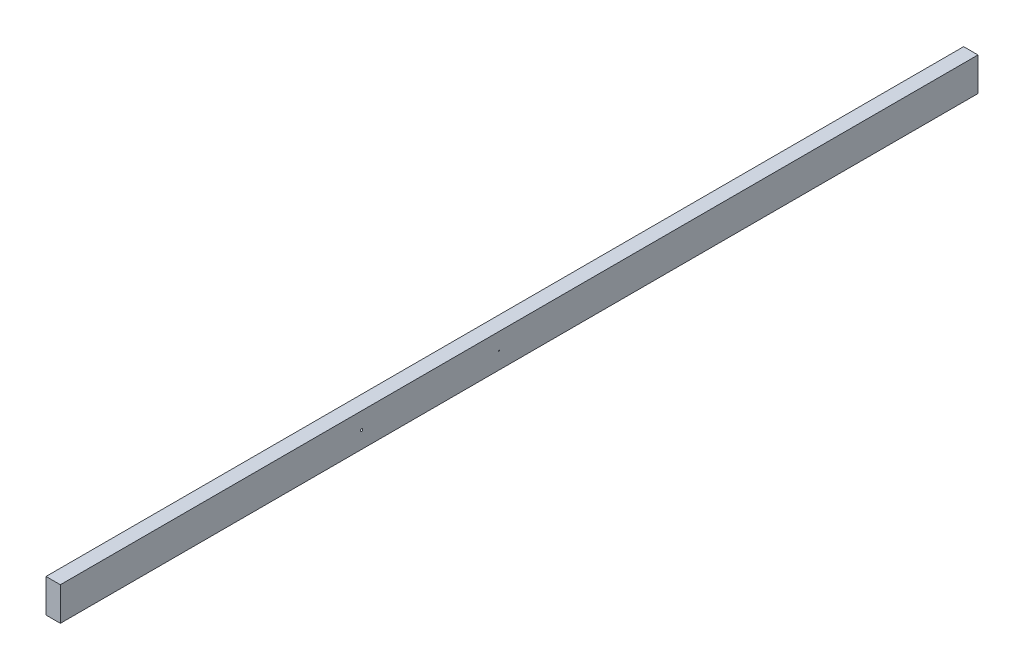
SolidWorks part; units mm, degrees
ref_plane "Front Plane" through (0, 0, 0) normal (0, 0, 1) x (1, 0, 0)
ref_plane "Top Plane" through (0, 0, 0) normal (0, 1, 0) x (1, 0, 0)
ref_plane "Right Plane" through (0, 0, 0) normal (1, 0, 0) x (0, 0, -1)
sketch "Sketch1" plane through (0, 0, 0) normal (0, 0, 1) x (1, 0, 0)
  line L1 (-19.05, -44.45) -> (19.05, -44.45)
  line L2 (-19.05, -44.45) -> (-19.05, 44.45)
  line L3 (-19.05, 44.45) -> (19.05, 44.45)
  line L4 (19.05, -44.45) -> (19.05, 44.45)
  line L5 (-19.05, -44.45) -> (19.05, 44.45) construction
  line L6 (-19.05, 44.45) -> (19.05, -44.45) construction
  point P0 (0, 0)
  dimension "D1" = 38.1
  dimension "D2" = 88.9
extrude "Boss-Extrude1" add sketch "Sketch1" against normal blind 2438.4
sketch "Sketch2" plane through (-19.05, 0, 0) normal (-1, 0, 0) x (0, 0, 1)
  line L0 (-1127.7854, -44.45) -> (-1127.7854, 44.45)
  line L4 (0, -44.45) -> (0, 44.45)
  line L5 (0, 44.45) -> (-2438.4, 44.45)
  line L6 (-2438.4, 44.45) -> (-2438.4, -44.45)
  line L7 (-2438.4, -44.45) -> (0, -44.45)
  line L8 (0, -44.45) -> (0, 44.45)
  line L9 (0, 44.45) -> (-2438.4, 44.45)
  line L10 (-2438.4, 44.45) -> (-2438.4, -44.45)
  line L11 (-2438.4, -44.45) -> (0, -44.45)
  dimension "D2" = 1127.7854
  dimension "D1" = 0
ref_plane "Plane1" through (554.3677, 0, -554.3677) normal (-0.7071, 0, 0.7071) x (0, 1, 0)
sketch "Sketch3" plane through (554.3677, 0, -554.3677) normal (-0.7071, 0, 0.7071) x (0, 1, 0)
  line L0 (44.45, 810.9351) -> (-44.45, 810.9351)
  circle A0 centre (0, 810.9351) radius 3.175
  dimension "D1" = 6.35
extrude "Cut-Extrude1" cut sketch "Sketch3" against normal blind 31.75 and the other way blind 50.8 contours A0
sketch "Sketch4" plane through (576.8183, 0, -576.8183) normal (-0.7071, 0, 0.7071) x (0.7071, 0, 0.7071)
  circle A0 centre (-810.9351, 0) radius 1.1906
  circle A1 centre (-810.9351, 0) radius 3.175
  circle A2 centre (-810.9351, 0) radius 3.175
  dimension "D2" = 2.3813
  dimension "D1" = 0
extrude "Cut-Extrude4" cut sketch "Sketch4" against normal blind 127 contours A0
sketch "Sketch5" plane through (-19.05, 0, 0) normal (-1, 0, 0) x (0, 0, 1)
  line L0 (0, 0) -> (-2438.4, 0) construction
  line L1 (-2438.4, 44.45) -> (-2438.4, -44.45) construction
  line L2 (0, 44.45) -> (0, -44.45) construction
  circle A0 centre (-800.1, 0) radius 3.175
  dimension "D1" = 6.35
  dimension "D2" = 800.1
extrude "Cut-Extrude5" cut sketch "Sketch5" against normal through all
